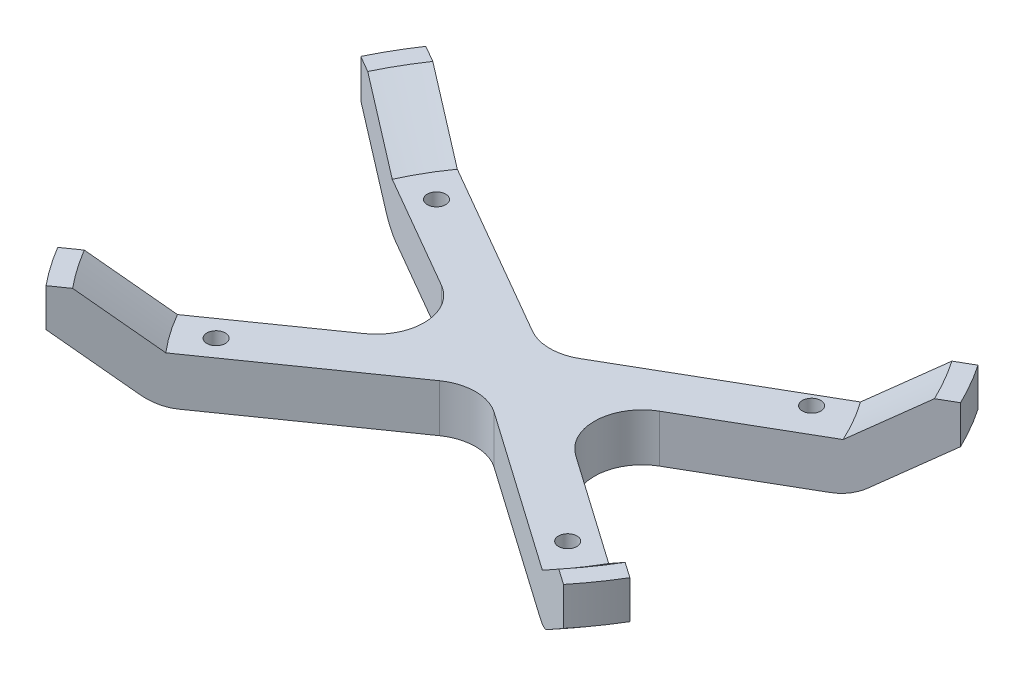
SolidWorks part; units mm, degrees
ref_plane "Front Plane" through (0, 0, 0) normal (0, 0, 1) x (1, 0, 0)
ref_plane "Top Plane" through (0, 0, 0) normal (0, 1, 0) x (1, 0, 0)
ref_plane "Right Plane" through (0, 0, 0) normal (1, 0, 0) x (0, 0, -1)
sketch "Sketch1" plane through (0, 0, 0) normal (0, -1, 0) x (1, 0, 0)
  line L0 (0, 0) -> (-76.9897, -44.45) construction
  line L2 (0, 0) -> (-103.684, 0) construction
  line L3 (0, 0) -> (-72.8226, 50.9909) construction
  line L4 (-79.968, -38.8372) -> (-11.8071, 0.5155)
  line L5 (-73.618, -49.8357) -> (0, -7.3323)
  line L6 (-76.2788, 45.6591) -> (-11.8071, 0.5155)
  line L7 (-68.9944, 56.0623) -> (0, 7.7519)
  line L8 (0, 0) -> (0, -54.341) construction
  line L9 (68.9944, 56.0623) -> (0, 7.7519)
  line L10 (76.2788, 45.6591) -> (11.8071, 0.5155)
  line L11 (79.968, -38.8372) -> (11.8071, 0.5155)
  line L13 (73.618, -49.8357) -> (0, -7.3323)
  circle A0 centre (0, 0) radius 88.9 construction
  arc A1 (-73.618, -49.8357) -> (-79.968, -38.8372) centre (0, 0) cw
  arc A2 (-76.2788, 45.6591) -> (-68.9944, 56.0623) centre (0, 0) cw
  arc A3 (76.2788, 45.6591) -> (68.9944, 56.0623) centre (0, 0) ccw
  arc A4 (73.618, -49.8357) -> (79.968, -38.8372) centre (0, 0) ccw
  dimension "D1" = 12.7
  dimension "D5" = 177.8
  dimension "D2" = 30
  dimension "D3" = 12.7
  dimension "D4" = 35
extrude "Boss-Extrude2" add sketch "Sketch1" along normal blind 25.4
ref_axis "Axis1" through (0, 97.79, 0) along (0, -1, 0)
ref_plane "Plane3" through (0, 0, 0) normal (0.5, 0, -0.866) x (-0.866, 0, -0.5)
sketch "Sketch9" plane through (0, 0, 0) normal (0.5, 0, -0.866) x (-0.866, 0, -0.5)
  line L0 (83.82, 0) -> (66.04, -12.7)
  line L1 (88.6729, 0) -> (3.6662, 0) construction
  line L2 (66.04, -12.7) -> (0, -12.7)
  line L3 (0, 97.79) -> (0, -97.79) construction
  line L4 (0, -12.7) -> (0, 10.3423)
  line L5 (0, 10.3423) -> (83.82, 10.3423)
  line L6 (83.82, 10.3423) -> (83.82, 0)
  line L7 (88.6729, 0) -> (9.9675, 0) construction
  line L8 (88.9, -10.16) -> (67.564, -25.4)
  line L10 (9.9675, -25.4) -> (88.6729, -25.4) construction
  line L11 (67.564, -25.4) -> (95.7216, -25.4)
  line L12 (95.7216, -25.4) -> (95.7216, -10.16)
  line L13 (95.7216, -10.16) -> (88.9, -10.16)
  line L14 (88.9, -25.4) -> (88.9, 0) construction
  dimension "D1" = 5.08
  dimension "D2" = 17.78
  dimension "D3" = 12.7
  dimension "D4" = 10.16
revolve "Cut-Revolve1" cut sketch "Sketch9" angle 360 about axis through (0, 97.79, 0) along (0, -1, 0)
sketch "Sketch3" plane through (0, -12.7, 0) normal (0, 1, 0) x (1, 0, 0)
  line L0 (-57.1923, 33.02) -> (0, 0) construction
  line L6 (0, 0) -> (-54.0968, -37.879) construction
  line L7 (0, 0) -> (54.0968, -37.879) construction
  line L8 (0, 0) -> (57.1923, 33.02) construction
  circle A0 centre (0, 7.62) radius 61.6712 construction
  circle A1 centre (0, 7.62) radius 61.6712 construction
  circle A2 centre (0, 7.62) radius 57.2262 construction
  arc A3 (-53.7523, 38.3663) -> (-60.1023, 27.3677) centre (0, 0) ccw construction
  arc A4 (-57.4884, -32.5019) -> (-50.2039, -42.9051) centre (0, 0) ccw construction
  arc A5 (50.2039, -42.9051) -> (57.4884, -32.5019) centre (0, 0) ccw construction
  arc A6 (60.1023, 27.3677) -> (53.7523, 38.3663) centre (0, 0) ccw construction
  dimension "D1" = 4.445
fillet "Fillet1" radius 12.7 8 edges at (-11.8071, -19.05, 0.5155) (0, -19.05, 7.7519) (11.8071, -19.05, 0.5155) (0, -19.05, -7.3323) (-58.5121, -25.4, -33.782) (58.5121, -25.4, -33.782) (55.3452, -25.4, 38.7531) (-55.3452, -25.4, 38.7531)
sketch "Sketch10" plane through (0, -25.4, 0) normal (0, -1, 0) x (1, 0, 0)
  line L0 (52.0113, 36.4187) -> (0, 0) construction
  line L1 (28.1369, 11.9498) -> (55.3928, 31.0345) construction
  line L3 (54.9875, -31.747) -> (0, 0) construction
  line L4 (0, 0) -> (-54.9875, -31.747) construction
  line L5 (0, 0) -> (-52.0113, 36.4187) construction
  line L6 (43.9941, -25.4) -> (52.4482, -10.757) construction
  line L7 (52.2242, -36.5678) -> (44.8908, -47.041) construction
  line L8 (52.2242, -36.5678) -> (43.9941, -25.4) construction
  arc A0 (55.3928, 31.0345) -> (48.1083, 41.4377) centre (0, 0) ccw construction
  arc A1 (51.5368, -37.0871) -> (57.8868, -26.0886) centre (0, 0) ccw construction
  arc A2 (-57.8868, -26.0886) -> (-51.5368, -37.0871) centre (0, 0) ccw construction
  arc A3 (-48.1083, 41.4377) -> (-55.3928, 31.0345) centre (0, 0) ccw construction
  circle A6 centre (0, 0) radius 50.8 construction
  circle A8 centre (0, 0) radius 57.2232 construction
  circle A9 centre (0, 0) radius 63.754 construction
  point P30 (48.1092, -30.9839)
hole_wizard "CBORE for #8 Socket Head Cap Screw2" positions "Sketch14" profile "Sketch13" counterbore size "#8" standard "ANSI Inch"
sketch "Sketch14" plane through (0, -25.4, 0) normal (0, -1, 0) x (-1, 0, 0)
  line L0 (0, 0) -> (-54.0968, -37.879) construction
  line L1 (0, 0) -> (76.9897, 44.45) construction
  line L2 (0, 0) -> (72.8226, -50.9909) construction
  circle A0 centre (0, 0) radius 57.2232 construction
  point P0 (-48.1092, 30.9839)
  point P3 (-46.8745, -32.8219)
  point P9 (49.5567, 28.6116)
  point P13 (46.8745, -32.8219)
sketch "Sketch13" plane through (48.1092, -25.4, -30.9839) normal (1, 0, 0) x (0, 0, -1)
  line L0 (0, 0) -> (0, 25.4)
  line L1 (0, 25.4) -> (2.4574, 25.4)
  line L3 (2.4574, 25.4) -> (2.4575, 5.4356)
  line L4 (2.4575, 5.4356) -> (3.9687, 5.4356)
  line L5 (3.9687, 5.4356) -> (3.9687, 0)
  line L7 (3.9687, 0) -> (0, 0)
  line L11 (0, -6.35) -> (0, 107.95) construction
  dimension "Thru Hole Dia." = 4.9149
  dimension "Thru Hole Depth" = 25.4
  dimension "C'Bore Dia." = 7.9375
  dimension "C'Bore Depth" = 5.4356
